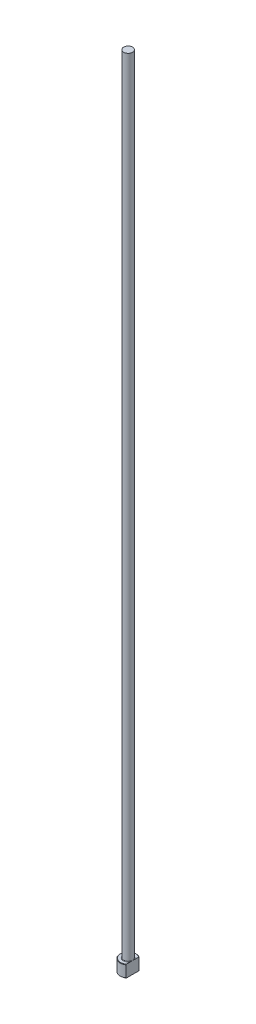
SolidWorks part; units mm, degrees
ref_plane "Front Plane" through (0, 0, 0) normal (0, 0, 1) x (1, 0, 0)
ref_plane "Top Plane" through (0, 0, 0) normal (0, 1, 0) x (1, 0, 0)
ref_plane "Right Plane" through (0, 0, 0) normal (1, 0, 0) x (0, 0, -1)
sketch "Sketch1" plane through (0, 0, 0) normal (0, 0, 1) x (1, 0, 0)
  line L0 (0, 259.9588) -> (0, -15.1925) construction
  line L1 (0, 0) -> (-4, 0)
  line L2 (-4, 0) -> (-4, 6)
  line L3 (-4, 6) -> (-2.25, 6)
  line L4 (-2.25, 6) -> (-2.25, 400)
  line L5 (-2.25, 400) -> (0, 400)
  line L6 (0, 400) -> (0, 0)
  dimension "L" = 400
  dimension "H" = 8
  dimension "T" = 6
  dimension "D" = 4.5
revolve "Revolve1" add sketch "Sketch1" angle 360 about L0
chamfer "Chamfer1" distance 0.2 angle 45 2 edges at (0, 6, 4) (0, 0, 4)
fillet "Fillet1" radius 0.2 1 edges at (0, 6, 2.25)
sketch "Sketch2" plane through (0, 0, 0) normal (0, 1, 0) x (1, 0, 0)
  line L0 (2.25, -3.3072) -> (2.25, 3.3072)
  circle A0 centre (0, 0) radius 4 construction
  arc A1 (2.25, -3.3072) -> (2.25, 3.3072) centre (0, 0) ccw
  circle A2 centre (0, 0) radius 2.25 construction
extrude "KEYED HEAD" cut sketch "Sketch2" along normal through all
